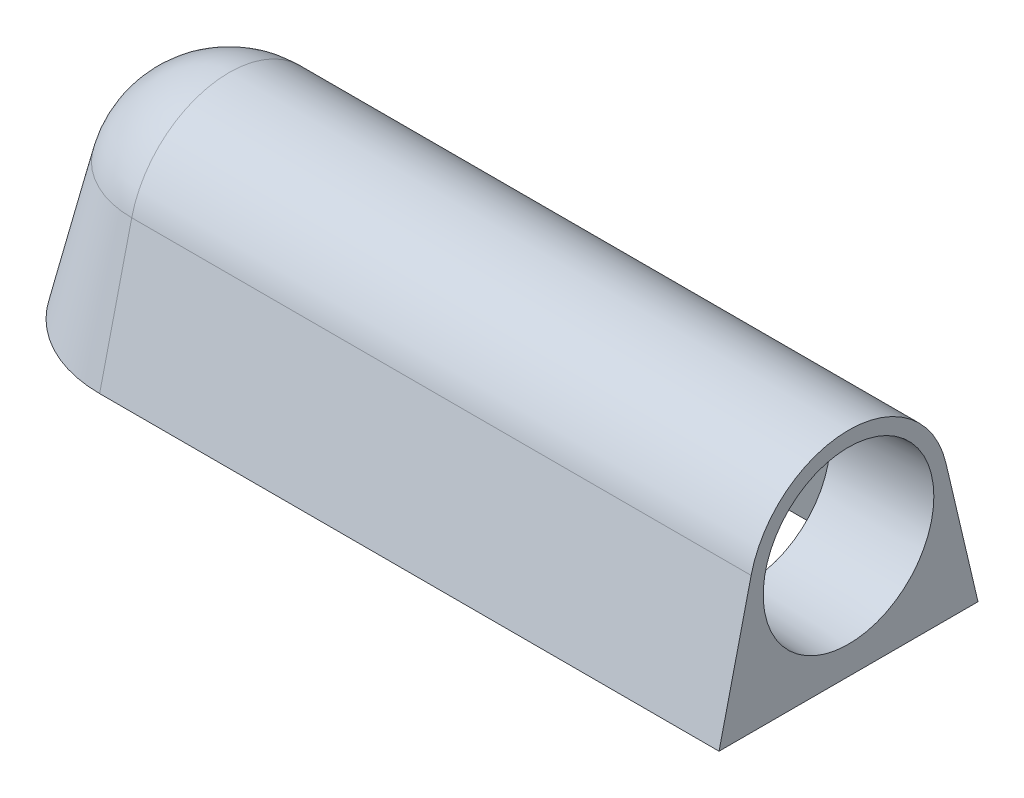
SolidWorks part; units mm, degrees
ref_plane "Front" through (0, 0, 0) normal (0, 0, 1) x (1, 0, 0)
ref_plane "Top" through (0, 0, 0) normal (0, 1, 0) x (1, 0, 0)
ref_plane "Right" through (0, 0, 0) normal (1, 0, 0) x (0, 0, -1)
sketch "Sketch1" plane through (0, 0, 0) normal (1, 0, 0) x (0, 0, -1)
  line L0 (0, 18.415) -> (0, 0) construction
  line L1 (8.4059, 11.7592) -> (11.176, 0)
  line L2 (11.176, 0) -> (0, 0)
  line L3 (0, 0) -> (0, 18.415)
  arc A0 (0, 18.415) -> (8.4059, 11.7592) centre (0, 9.779) cw
  dimension "D1" = 22.352
  dimension "D2" = 17.272
  dimension "D3" = 18.415
revolve "Base-Revolve" add sketch "Sketch1" angle 180 about L0
sketch "Sketch2" plane through (0, 0, 0) normal (1, 0, 0) x (0, 0, -1)
  line L3 (-11.176, 0) -> (11.176, 0)
  line L4 (11.176, 0) -> (8.4059, 11.7592)
  line L5 (-8.4059, 11.7592) -> (-11.176, 0)
  line L6 (-11.176, 0) -> (11.176, 0)
  line L7 (11.176, 0) -> (8.4059, 11.7592)
  line L8 (-8.4059, 11.7592) -> (-11.176, 0)
  arc A1 (8.4059, 11.7592) -> (-8.4059, 11.7592) centre (0, 9.779) ccw
  arc A2 (8.4059, 11.7592) -> (-8.4059, 11.7592) centre (0, 9.779) ccw
  dimension "D1" = 0
extrude "Boss-Extrude1" add sketch "Sketch2" along normal blind 53.467
sketch "Sketch3" plane through (53.467, 4.3074, 1.2427) normal (1, 0, 0) x (0, 0, -1)
  circle A0 centre (1.2427, 5.4716) radius 7.366
  circle A1 centre (1.2427, 5.4716) radius 8.636 construction
  dimension "Diam" = 14.732
extrude "Cut-Extrude1" cut sketch "Sketch3" against normal blind 8.636 draft 2
other "LibFeat1"
shell "Shell1" thickness 1.27
